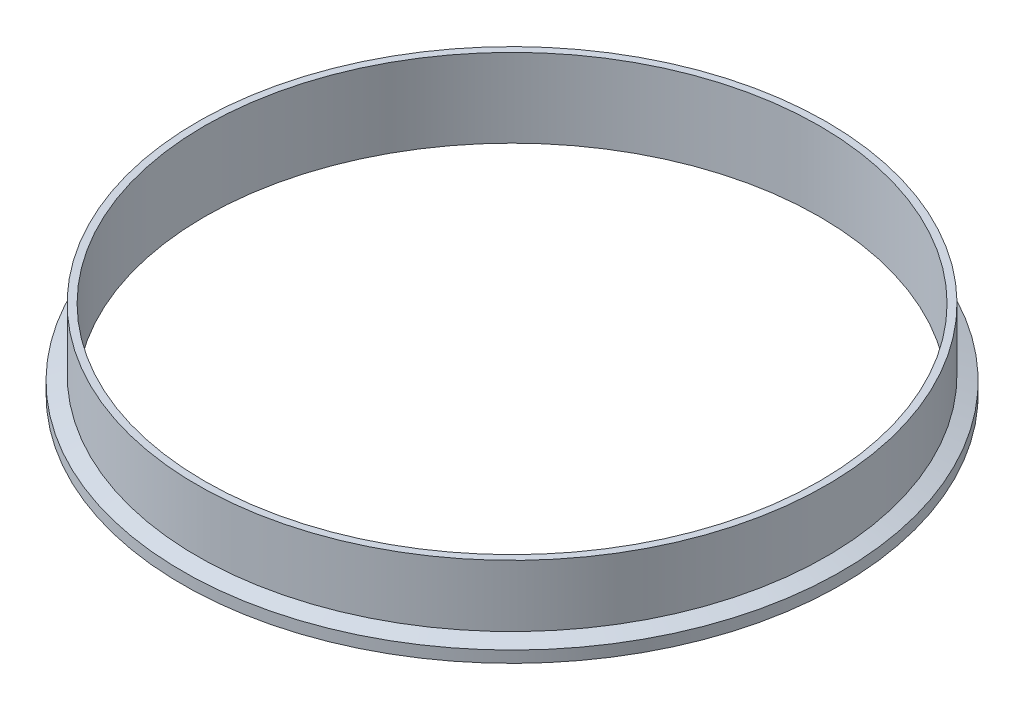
SolidWorks part; units mm, degrees
ref_plane "Front Plane" through (0, 0, 0) normal (0, 0, 1) x (1, 0, 0)
ref_plane "Top Plane" through (0, 0, 0) normal (0, 1, 0) x (1, 0, 0)
ref_plane "Right Plane" through (0, 0, 0) normal (1, 0, 0) x (0, 0, -1)
sketch "Sketch1" plane through (0, 0, 0) normal (0, 0, 1) x (1, 0, 0)
  line L0 (0, 0) -> (0, 38.1) construction
  line L1 (0, 38.1) -> (-152.4, 38.1)
  line L2 (-152.4, 38.1) -> (-152.4, 8.2228)
  line L3 (-152.4, 8.2228) -> (-159.639, 5.588)
  line L4 (-159.639, 5.588) -> (-159.639, 0)
  line L5 (-159.639, 0) -> (-156.1992, 0)
  line L6 (-152.5632, 0) -> (0, 0)
  line L7 (0, 0) -> (0, 38.1)
  line L8 (0, 38.1) -> (-148.9964, 38.1)
  line L9 (-148.9964, 38.1) -> (-148.9964, 0)
  line L10 (-148.9964, 0) -> (0, 0)
  line L11 (0, 0) -> (-0.1846, 0.0129)
  arc A0 (-155.4767, 0.4745) -> (-153.2857, 0.4745) centre (-154.3812, 0) cw
  arc A1 (-152.5632, 0) -> (-153.2857, 0.4745) centre (-152.5632, 0.7874) cw
  arc A2 (-155.4767, 0.4745) -> (-156.1992, 0) centre (-156.1992, 0.7874) cw
  point P12 (-153.1874, 0)
  dimension "D6" = 1.1938
  dimension "D7" = 0.7874
  dimension "3.00" = 152.4
  dimension "D2" = 5.588
  dimension "D3" = 159.639
  dimension "D4" = 70
  dimension "D5" = 154.3812
  dimension "D8" = 3.4036
  dimension "D9" = 38.1
revolve "Revolve2" add sketch "Sketch1" angle 360 about L0
